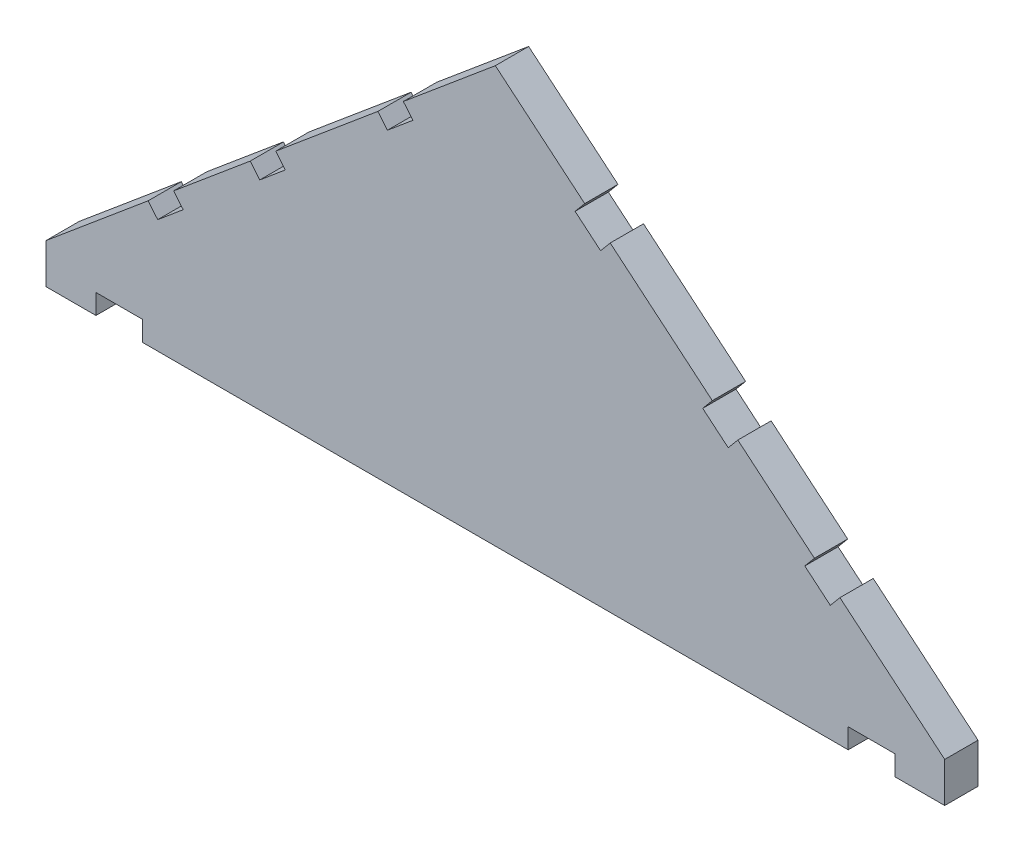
SolidWorks part; units mm, degrees
ref_plane "Face" through (0, 0, 0) normal (0, 0, 1) x (1, 0, 0)
ref_plane "Dessus" through (0, 0, 0) normal (0, 1, 0) x (1, 0, 0)
ref_plane "Droite" through (0, 0, 0) normal (1, 0, 0) x (0, 0, -1)
sketch "Esquisse1" plane through (0, 0, 0) normal (0, 0, 1) x (1, 0, 0)
  line L1 (-66.5954, -169.4965) -> (203.4046, -169.4965)
  line L2 (-66.5954, -169.4965) -> (-66.5954, -44.4965)
  line L3 (-66.5954, -44.4965) -> (203.4046, -44.4965)
  line L4 (203.4046, -169.4965) -> (203.4046, -44.4965)
  dimension "D1" = 270
  dimension "D2" = 125
extrude "Extrusion1" add sketch "Esquisse1" along normal blind 10
sketch "Esquisse2" plane through (0, 0, 10) normal (0, 0, 1) x (1, 0, 0)
  line L0 (-66.5954, -157.4965) -> (68.4046, -44.4965)
  line L1 (-66.5954, -44.4965) -> (-66.5954, -169.4965) construction
  line L2 (203.4046, -44.4965) -> (-66.5954, -44.4965) construction
  line L3 (68.4046, -44.4965) -> (203.4046, -157.4965)
  line L4 (203.4046, -169.4965) -> (203.4046, -44.4965) construction
  dimension "D1" = 12
  dimension "D2" = 12
  dimension "D3" = 135
extrude "Enlèv. mat.-Extru.5" cut sketch "Esquisse2" against normal through all and the other way through all
sketch "Esquisse11" plane through (0, 0, 10) normal (0, 0, 1) x (1, 0, 0)
  line L0 (-66.5954, -169.4965) -> (203.4046, -169.4965) construction
  line L1 (-51.5954, -169.4965) -> (-37.5954, -169.4965)
  line L2 (-51.5954, -169.4965) -> (-51.5954, -163.4965)
  line L3 (-51.5954, -163.4965) -> (-37.5954, -163.4965)
  line L4 (-37.5954, -169.4965) -> (-37.5954, -163.4965)
  line L6 (174.4046, -169.4965) -> (188.4046, -169.4965)
  line L7 (174.4046, -169.4965) -> (174.4046, -163.4965)
  line L8 (174.4046, -163.4965) -> (188.4046, -163.4965)
  line L9 (188.4046, -169.4965) -> (188.4046, -163.4965)
  dimension "D1" = 14
  dimension "D2" = 15
  dimension "D3" = 6
  dimension "D4" = 15
  dimension "D5" = 14
  dimension "D6" = 6
extrude "Enlèv. mat.-Extru.6" cut sketch "Esquisse11" against normal blind 10
sketch "Esquisse14" plane through (0, 0, 10) normal (0, 0, 1) x (1, 0, 0)
  line L0 (-35.9225, -131.8221) -> (-28.2543, -125.4035)
  line L1 (-66.5954, -157.4965) -> (68.4046, -44.4965) construction
  line L2 (-28.2543, -125.4035) -> (-25.3659, -128.8542)
  line L3 (-25.3659, -128.8542) -> (-33.0341, -135.2728)
  line L4 (-33.0341, -135.2728) -> (-35.9225, -131.8221)
  dimension "D1" = 10
  dimension "D2" = 4.5
  dimension "D3" = 40
extrude "Enlèv. mat.-Extru.7" cut sketch "Esquisse14" against normal blind 10
sketch "Esquisse15" plane through (0, 0, 10) normal (0, 0, 1) x (1, 0, 0)
  line L0 (-5.2496, -106.1478) -> (2.4186, -99.7292)
  line L1 (-28.2543, -125.4035) -> (68.4046, -44.4965) construction
  line L2 (2.4186, -99.7292) -> (5.307, -103.1799)
  line L3 (5.307, -103.1799) -> (-2.3612, -109.5985)
  line L4 (-2.3612, -109.5985) -> (-5.2496, -106.1478)
  dimension "D1" = 80
  dimension "D2" = 10
  dimension "D3" = 4.5
  dimension "D4" = 10
extrude "Enlèv. mat.-Extru.9" cut sketch "Esquisse15" against normal blind 10
sketch "Esquisse16" plane through (0, 0, 10) normal (0, 0, 1) x (1, 0, 0)
  line L0 (33.0915, -74.0548) -> (40.7598, -67.6362)
  line L1 (2.4186, -99.7292) -> (68.4046, -44.4965) construction
  line L2 (40.7598, -67.6362) -> (43.6481, -71.0869)
  line L3 (43.6481, -71.0869) -> (35.9799, -77.5055)
  line L4 (35.9799, -77.5055) -> (33.0915, -74.0548)
  dimension "D1" = 4.5
  dimension "D2" = 10
  dimension "D3" = 10
  dimension "D4" = 130
extrude "Enlèv. mat.-Extru.10" cut sketch "Esquisse16" against normal blind 10
sketch "Esquisse17" plane through (0, 0, 10) normal (0, 0, 1) x (1, 0, 0)
  line L0 (95.2434, -66.9616) -> (92.355, -70.4123)
  line L1 (68.4046, -44.4965) -> (203.4046, -157.4965) construction
  line L2 (92.355, -70.4123) -> (100.0232, -76.8308)
  line L3 (100.0232, -76.8308) -> (102.9116, -73.3801)
  dimension "D1" = 10
  dimension "D2" = 4.5
  dimension "D3" = 10
  dimension "D4" = 35
extrude "Enlèv. mat.-Extru.11" cut sketch "Esquisse17" against normal through all and the other way through all
sketch "Esquisse20" plane through (0, 0, 10) normal (0, 0, 1) x (1, 0, 0)
  line L0 (133.5845, -99.0545) -> (130.6961, -102.5052)
  line L1 (102.9116, -73.3801) -> (203.4046, -157.4965) construction
  line L2 (130.6961, -102.5052) -> (138.3644, -108.9238)
  line L3 (138.3644, -108.9238) -> (141.2527, -105.4731)
  line L4 (141.2527, -105.4731) -> (133.5845, -99.0545)
  dimension "D1" = 10
  dimension "D2" = 4.5
  dimension "D3" = 85
extrude "Enlèv. mat.-Extru.20" cut sketch "Esquisse20" against normal blind 10
sketch "Esquisse21" plane through (0, 0, 10) normal (0, 0, 1) x (1, 0, 0)
  line L0 (164.2574, -124.7289) -> (161.369, -128.1796)
  line L1 (141.2527, -105.4731) -> (203.4046, -157.4965) construction
  line L2 (161.369, -128.1796) -> (169.0373, -134.5982)
  line L3 (169.0373, -134.5982) -> (171.9256, -131.1475)
  line L4 (171.9256, -131.1475) -> (164.2574, -124.7289)
  dimension "D1" = 10
  dimension "D2" = 4.5
  dimension "D3" = 125
extrude "Enlèv. mat.-Extru.21" cut sketch "Esquisse21" against normal blind 10
